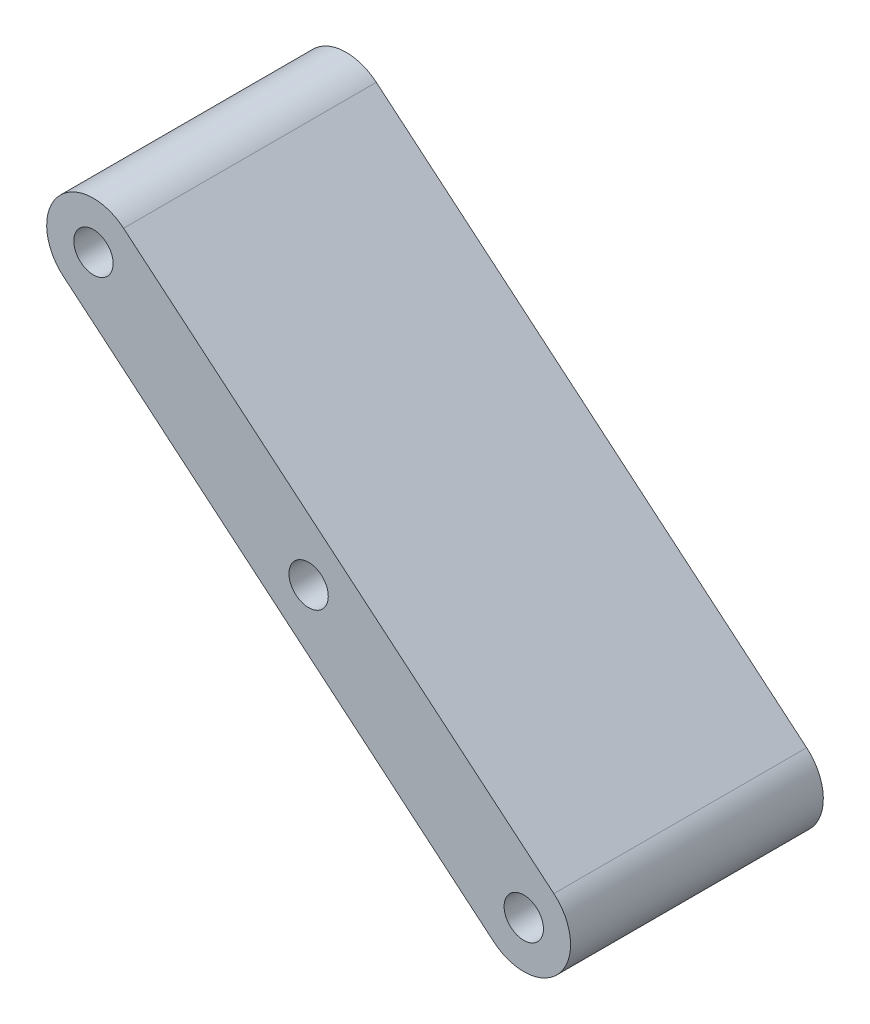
SolidWorks part; units mm, degrees
ref_plane "Front Plane" through (0, 0, 0) normal (0, 0, 1) x (1, 0, 0)
ref_plane "Top Plane" through (0, 0, 0) normal (0, 1, 0) x (1, 0, 0)
ref_plane "Right Plane" through (0, 0, 0) normal (1, 0, 0) x (0, 0, -1)
sketch "Sketch1" plane through (0, 0, 10) normal (0, 0, 1) x (1, 0, 0)
  line L0 (44.6638, -44.0044) -> (90.6265, -82.5717)
  line L1 (51.0917, -36.344) -> (97.0544, -74.9113)
  circle A0 centre (47.8778, -40.1742) radius 2.1
  circle A1 centre (70.8591, -59.4579) radius 2.1
  circle A2 centre (93.8404, -78.7415) radius 2.1
  arc A3 (51.0917, -36.344) -> (44.6638, -44.0044) centre (47.8778, -40.1742) ccw
  arc A4 (90.6265, -82.5717) -> (97.0544, -74.9113) centre (93.8404, -78.7415) ccw
extrude "Boss-Extrude1" add sketch "Sketch1" along normal blind 27
equation "\"thighLength\"=185"
equation "\"legLength\"=200"
equation "\"m3Thru\"=3.2"
equation "\"m4Thru\"=4.3"
equation "\"m3Insert\"=4.2"
equation "\"m4Insert\"=5.3"
equation "\"shoulder5mm\"=5.1"
equation "\"6706out\"=37.125"
equation "\"6706in\"=30"
equation "\"6904out\"=30.125"
equation "\"6904in\"=17"
equation "\"D1@Sketch1\"=\"m3Insert\" "
equation "\"D2@Sketch1\"=\"m3Insert\" "
equation "\"D3@Sketch1\"=\"m3Insert\" "
